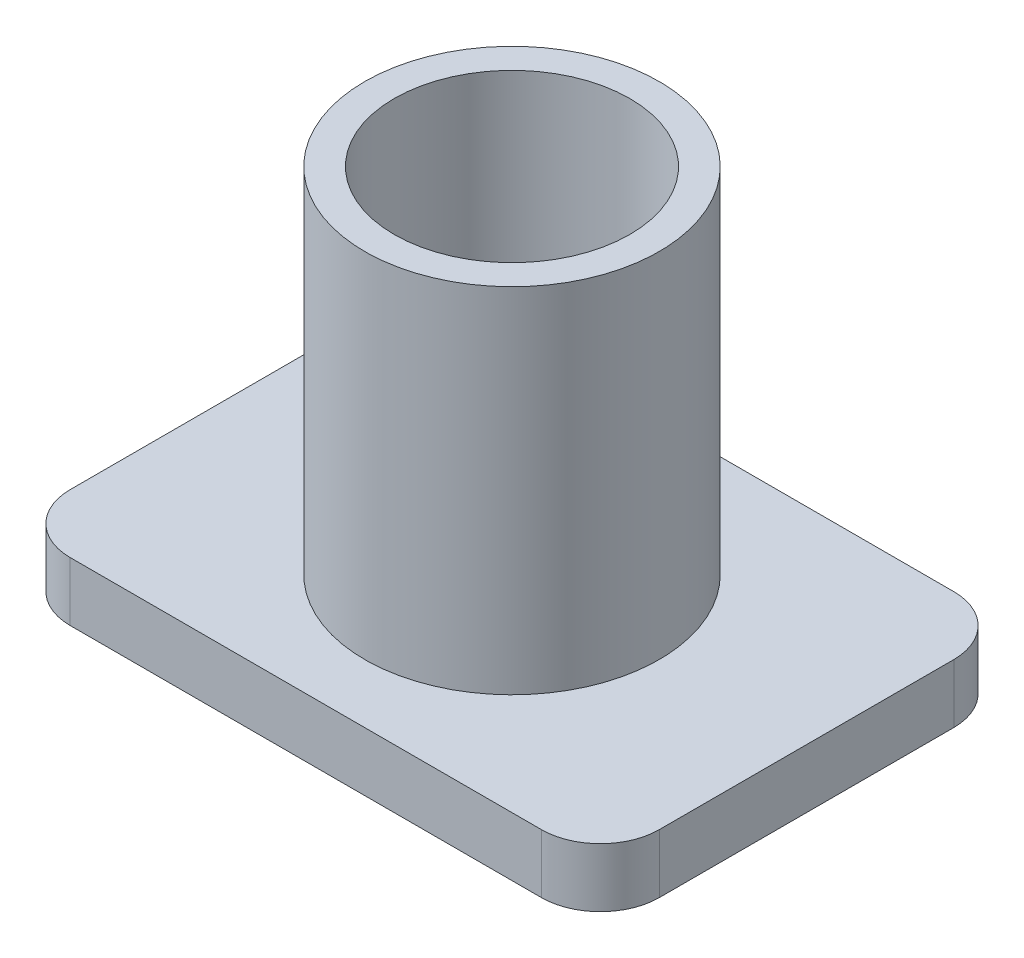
SolidWorks part; units mm, degrees
ref_plane "Front Plane" through (0, 0, 0) normal (0, 0, 1) x (1, 0, 0)
ref_plane "Top Plane" through (0, 0, 0) normal (0, 1, 0) x (1, 0, 0)
ref_plane "Right Plane" through (0, 0, 0) normal (1, 0, 0) x (0, 0, -1)
sketch "Sketch1" plane through (0, 0, 0) normal (0, 1, 0) x (1, 0, 0)
  line L0 (-25, 17.5) -> (25, -17.5) construction
  line L1 (-25, 17.5) -> (25, 17.5)
  line L2 (-25, 17.5) -> (-25, -17.5)
  line L3 (-25, -17.5) -> (25, -17.5)
  line L4 (25, 17.5) -> (25, -17.5)
  dimension "D1" = 50
  dimension "D2" = 35
extrude "Extrude1" add sketch "Sketch1" along normal blind 5
sketch "Sketch2" plane through (0, 5, 0) normal (0, 1, 0) x (-1, 0, 0)
  circle A0 centre (0, 0) radius 10
  dimension "D1" = 20
extrude "Extrude-Thin1" add sketch "Sketch2" along normal blind 30 thin
fillet "Fillet1" radius 5 4 edges at (25, 2.5, 17.5) (25, 2.5, -17.5) (-25, 2.5, -17.5) (-25, 2.5, 17.5)
